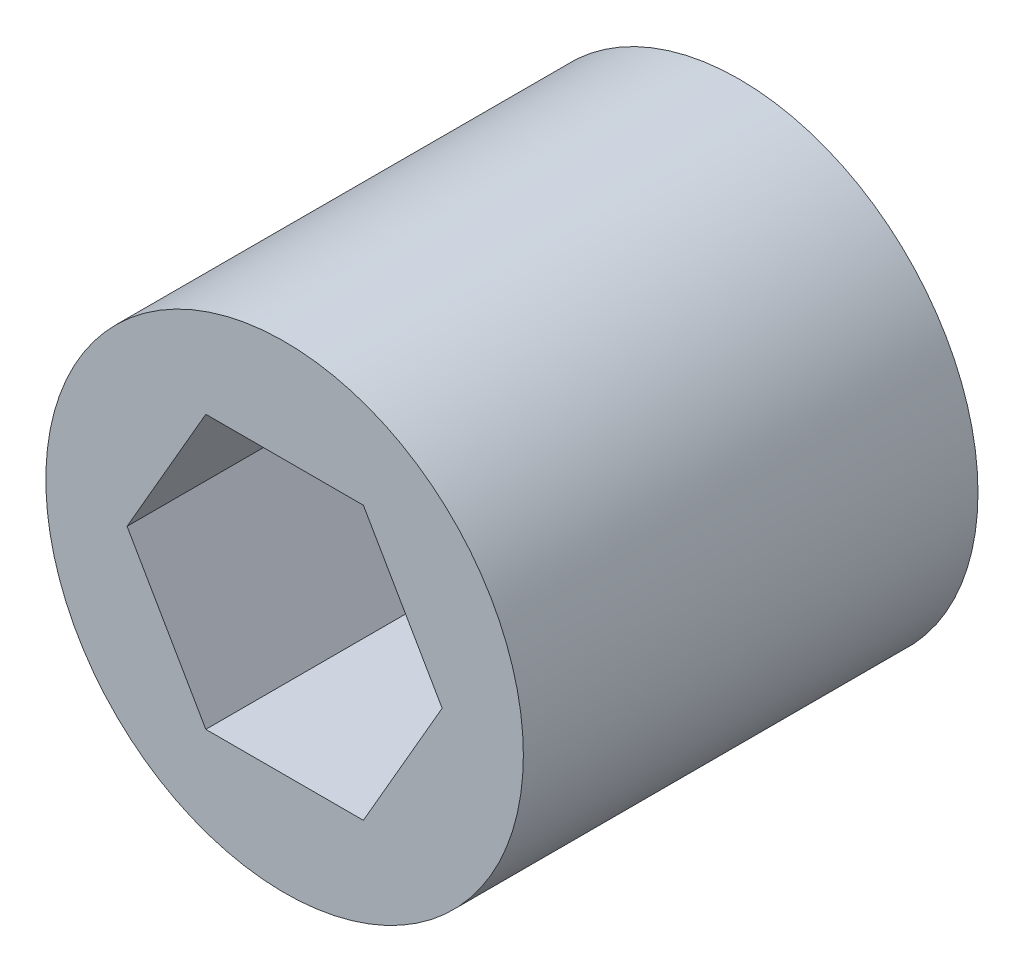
SolidWorks part; units mm, degrees
ref_plane "Plan de face" through (0, 0, 0) normal (0, 0, 1) x (1, 0, 0)
ref_plane "Plan de dessus" through (0, 0, 0) normal (0, 1, 0) x (1, 0, 0)
ref_plane "Plan de droite" through (0, 0, 0) normal (1, 0, 0) x (0, 0, -1)
sketch "Esquisse1" plane through (0, 0, 0) normal (0, 0, 1) x (1, 0, 0)
  line L1 (-2.3094, 0) -> (-1.1547, -2)
  line L2 (-1.1547, -2) -> (1.1547, -2)
  line L3 (1.1547, -2) -> (2.3094, 0)
  line L4 (2.3094, 0) -> (1.1547, 2)
  line L5 (1.1547, 2) -> (-1.1547, 2)
  line L6 (-1.1547, 2) -> (-2.3094, 0)
  circle A0 centre (0, 0) radius 3.5
  circle A1 centre (0, 0) radius 2 construction
  dimension "D1" = 7
  dimension "D2" = 2
extrude "Extrusion1" add sketch "Esquisse1" against normal blind 4
sketch "Esquisse2" plane through (0, 0, -4) normal (0, 0, -1) x (-1, 0, 0)
  circle A0 centre (0, 0) radius 3.5
  dimension "D1" = 7
extrude "Extrusion2" add sketch "Esquisse2" along normal blind 4
ref_plane "Plan2" through (0, 0, -8) normal (0, 0, -1) x (-1, 0, 0)
sketch "Esquisse5" plane through (0, 0, -8) normal (0, 0, -1) x (-1, 0, 0)
  circle A0 centre (0, 0) radius 0.5
  dimension "D1" = 1
extrude "Extrusion10" cut sketch "Esquisse5" against normal blind 4 draft 66 flip side to cut
